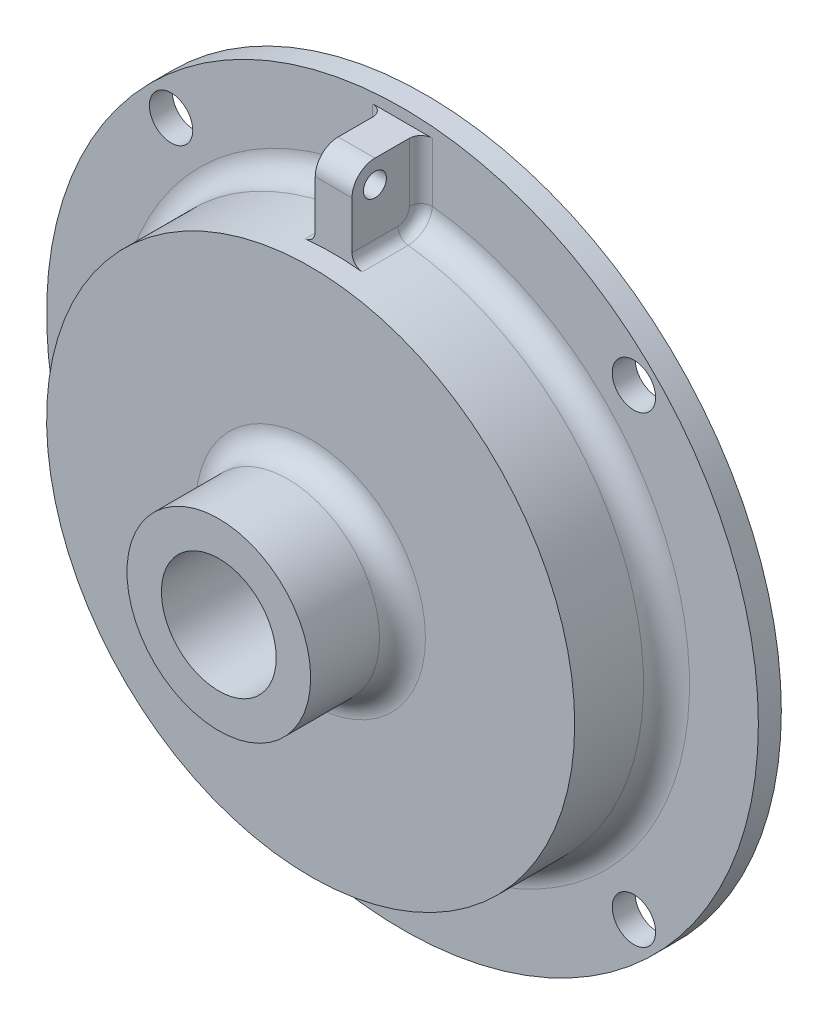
SolidWorks part; units mm, degrees
ref_plane "Front" through (0, 0, 0) normal (0, 0, 1) x (1, 0, 0)
ref_plane "Top" through (0, 0, 0) normal (0, 1, 0) x (1, 0, 0)
ref_plane "Right" through (0, 0, 0) normal (1, 0, 0) x (0, 0, -1)
sketch "Sketch1" plane through (0, 0, 0) normal (0, 0, 1) x (1, 0, 0)
  circle A0 centre (0, 0) radius 49.2125
  dimension "D1" = 98.425
extrude "Base-Extrude" add sketch "Sketch1" along normal blind 3.175
hole_wizard "Ø6.0 (6) Diameter Hole1" positions "Sketch9" profile "Sketch8" hole size "Ø6.0" standard "Ansi Metric"
sketch "Sketch9" plane through (0, 0, 3.175) normal (0, 0, 1) x (1, 0, 0)
  line L0 (0, 0) -> (73.9348, 0) construction
  line L1 (0, 0) -> (52.162, 52.162) construction
  line L2 (0, 0) -> (32, -32) construction
  line L3 (0, 0) -> (-32, -32) construction
  line L4 (0, 0) -> (-32, 32) construction
  circle A0 centre (0, 0) radius 45.2548 construction
  point P0 (32, 32)
  point P22 (-32, 32)
  point P24 (-32, -32)
  point P26 (32, -32)
  dimension "BOLT_CIR" = 45.2548
  dimension "D1" = 45
sketch "Sketch8" plane through (32, 32, 3.175) normal (1, 0, 0) x (0, -1, 0)
  line L0 (0, 0) -> (0, 3.175)
  line L1 (0, 3.175) -> (3, 3.175)
  line L2 (3, 3.175) -> (3, 0)
  line L5 (3, 0) -> (0, 0)
  line L11 (0, -6.35) -> (0, 107.95) construction
  dimension "Thru Hole Dia." = 6
  dimension "Thru Hole Depth" = 3.175
sketch "Sketch2" plane through (0, 0, 3.175) normal (0, 0, 1) x (1, 0, 0)
  circle A0 centre (0, 0) radius 36.5125
  dimension "D1" = 73.025
extrude "Boss-Extrude1" add sketch "Sketch2" along normal blind 12.7
sketch "Sketch3" plane through (0, 0, 15.875) normal (0, 0, 1) x (1, 0, 0)
  circle A0 centre (0, 0) radius 12.7
  dimension "D1" = 25.4
extrude "Boss-Extrude2" add sketch "Sketch3" along normal blind 12.7
fillet "Fillet1" radius 3.175 2 edges at (36.5125, 0, 3.175) (12.7, 0, 15.875)
sketch "Sketch6" plane through (0, 0, 0) normal (0, 1, 0) x (1, 0, 0)
  line L0 (-2.54, -3.175) -> (-2.54, -12.7)
  line L1 (-39.6875, -3.175) -> (39.6875, -3.175) construction
  line L2 (-2.54, -3.175) -> (2.54, -3.175)
  line L3 (-49.2125, -3.175) -> (49.2125, -3.175) construction
  line L4 (2.54, -3.175) -> (2.54, -12.7)
  line L5 (-2.54, -12.7) -> (2.54, -12.7)
  line L6 (0, 0) -> (0, -38.11) construction
  line L7 (0, -3.175) -> (0, 0) construction
  dimension "D1" = 5.08
  dimension "D2" = 9.525
extrude "Boss-Extrude3" add sketch "Sketch6" along normal blind 47.625
sketch "Sketch4" plane through (0, 0, 28.575) normal (0, 0, 1) x (1, 0, 0)
  circle A0 centre (0, 0) radius 7.9375
  dimension "D1" = 15.875
extrude "Cut-Extrude1" cut sketch "Sketch4" against normal through all
fillet "Fillet2" radius 3.175 1 edges at (0, 47.625, 12.7)
sketch "Sketch7" plane through (2.54, 0, 0) normal (1, 0, 0) x (0, 0, -1)
  circle A0 centre (-9.525, 44.45) radius 1.5875
  arc A1 (-9.525, 47.625) -> (-12.7, 44.45) centre (-9.525, 44.45) ccw construction
  dimension "D1" = 3.175
extrude "Cut-Extrude3" cut sketch "Sketch7" against normal up to next
fillet "Fillet3" radius 1.5875 6 edges at (2.54, 41.6917, 8.7475) (-2.54, 41.6917, 8.7475) (2.54, 43.6156, 3.175) (-2.54, 36.424, 9.525) (-2.54, 43.6156, 3.175) (2.54, 36.424, 9.525)
